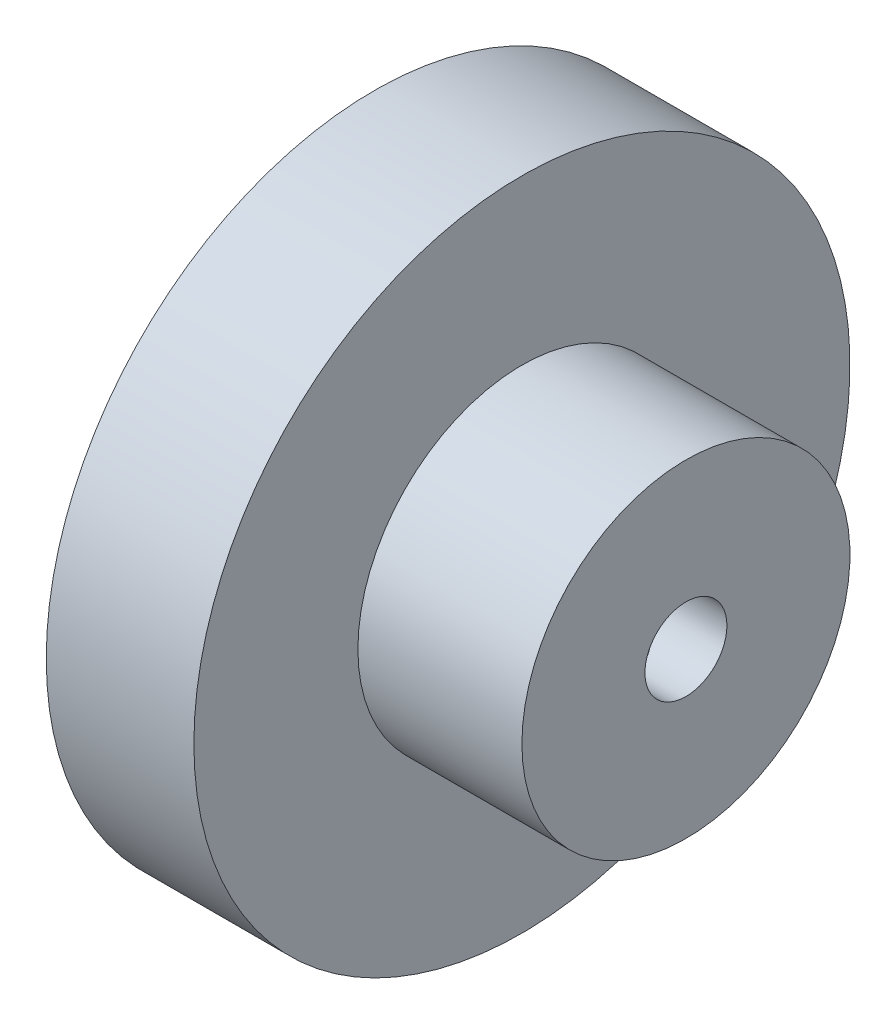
SolidWorks part; units mm, degrees
ref_plane "Front" through (0, 0, 0) normal (0, 0, 1) x (1, 0, 0)
ref_plane "Top" through (0, 0, 0) normal (0, 1, 0) x (1, 0, 0)
ref_plane "Right" through (0, 0, 0) normal (1, 0, 0) x (0, 0, -1)
sketch "Sketch1" plane through (0, 0, 0) normal (0, 1, 0) x (1, 0, 0)
  line L0 (0, 0) -> (19, 0)
  line L1 (19, 0) -> (19, 10)
  line L2 (19, 10) -> (9, 10)
  line L3 (9, 10) -> (9, 20)
  line L4 (9, 20) -> (0, 20)
  line L5 (0, 20) -> (0, 0)
revolve "Revolve1" add sketch "Sketch1" angle 360 about L0
sketch "Sketch2" plane through (19, 0, 0) normal (1, 0, 0) x (0, 0, -1)
  circle A0 centre (0, 0) radius 2.5
extrude "Cut-Extrude1" cut sketch "Sketch2" against normal through all
sketch "Sketch3" plane through (0, 0, 0) normal (0, 1, 0) x (1, 0, 0)
  circle A0 centre (14, 0) radius 2
extrude "Cut-Extrude2" cut sketch "Sketch3" against normal blind 10
